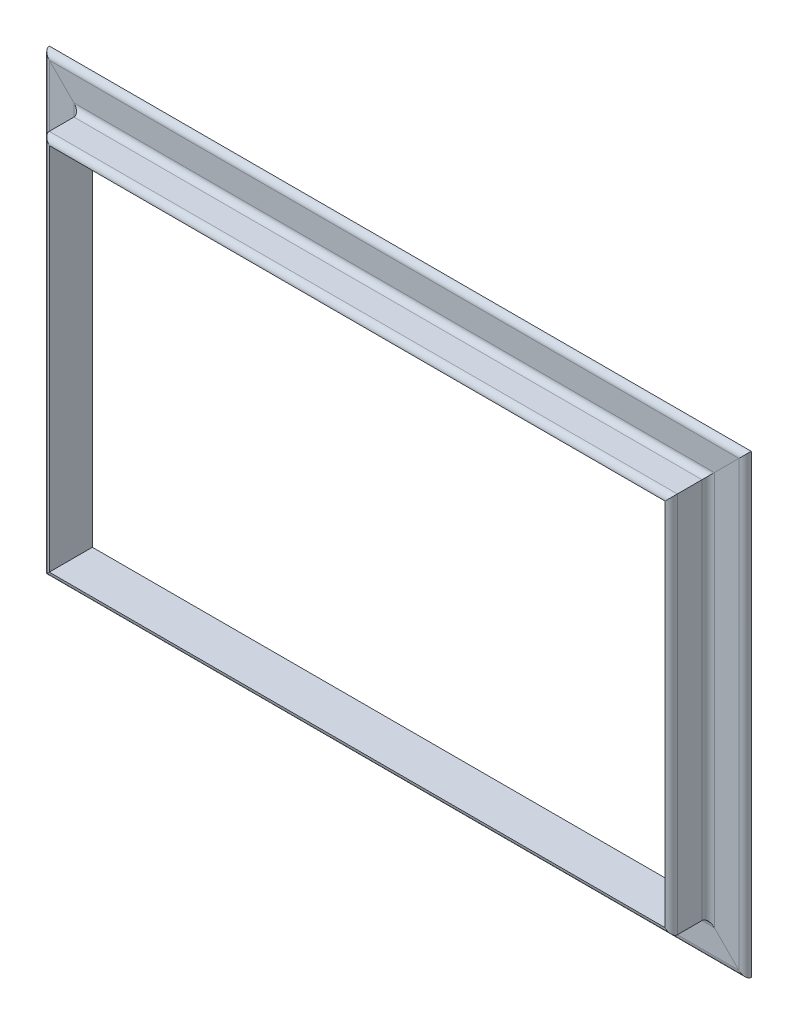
SolidWorks part; units mm, degrees
ref_plane "Płaszczyzna przednia" through (0, 0, 0) normal (0, 0, 1) x (1, 0, 0)
ref_plane "Płaszczyzna górna" through (0, 0, 0) normal (0, 1, 0) x (1, 0, 0)
ref_plane "Płaszczyzna prawa" through (0, 0, 0) normal (1, 0, 0) x (0, 0, -1)
sketch "Szkic1" plane through (0, 0, 0) normal (0, 0, 1) x (1, 0, 0)
  line L0 (0, 150) -> (0, -150)
  line L1 (250, -150) -> (-250, -150)
  line L2 (250, -150) -> (250, 150)
  line L3 (250, 150) -> (-250, 150)
  line L4 (-250, -150) -> (-250, 150)
  line L5 (250, -150) -> (-250, 150) construction
  line L6 (250, 150) -> (-250, -150) construction
  line L7 (-250, 0) -> (250, 0)
  point P0 (0, 0)
  dimension "D1" = 300
  dimension "D2" = 500
other "Kątownik stalowy 35 X 35 X 5(1)"
ref_plane "Płaszczyzna2" through (250, -150, 0) normal (-1, 0, 0) x (0, -1, 0)
sketch "Sketch1" plane through (250, -150, 0) normal (-1, 0, 0) x (0, -1, 0)
  line L0 (0, 0) -> (0, 35)
  line L1 (0, 17.5) -> (5, 17.5) construction
  line L2 (5, 30) -> (5, 10)
  line L3 (10, 5) -> (30, 5)
  line L4 (17.5, 5) -> (17.5, 0) construction
  line L5 (35, 0) -> (0, 0)
  arc A0 (35, 0) -> (30, 5) centre (30, 0) ccw
  arc A1 (0, 35) -> (5, 30) centre (0, 30) cw
  arc A2 (10, 5) -> (5, 10) centre (10, 10) cw
  point P10 (17.5, 0)
  point P14 (0, 17.5)
  point P15 (5, 17.5)
  point P16 (17.5, 5)
  point P17 (5, 35)
  point P18 (35, 5)
  point P21 (0, 0)
  dimension "D2" = 5
  dimension "D3" = 35
  dimension "Radius_1" = 5
  dimension "D1" = 5
